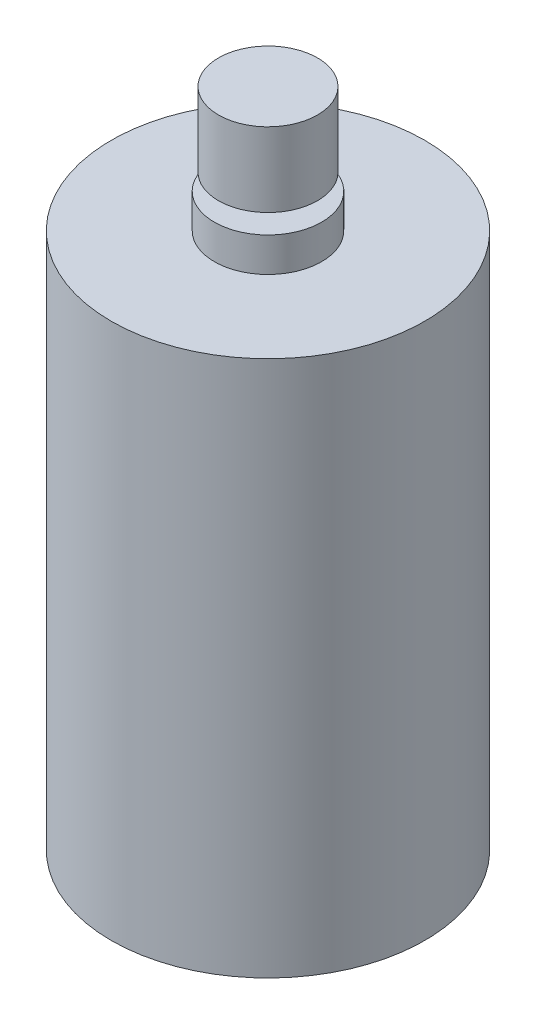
SolidWorks part; units mm, degrees
ref_plane "Ebene vorne" through (0, 0, 0) normal (0, 0, 1) x (1, 0, 0)
ref_plane "Ebene oben" through (0, 0, 0) normal (0, 1, 0) x (1, 0, 0)
ref_plane "Ebene rechts" through (0, 0, 0) normal (1, 0, 0) x (0, 0, -1)
sketch "Skizze1" plane through (0, 0, 0) normal (0, 1, 0) x (1, 0, 0)
  circle A0 centre (0, 0) radius 19
  dimension "D1" = 38
extrude "Aufsatz-Linear austragen1" add sketch "Skizze1" along normal blind 65
sketch "Skizze2" plane through (0, 65, 0) normal (0, 1, 0) x (1, 0, 0)
  circle A0 centre (0, 0) radius 6.5
  dimension "D1" = 13
extrude "Aufsatz-Linear austragen2" add sketch "Skizze2" along normal blind 4.15
sketch "Skizze3" plane through (0, 69.15, 0) normal (0, 1, 0) x (1, 0, 0)
  circle A0 centre (0, 0) radius 1
  dimension "D1" = 2
extrude "Aufsatz-Linear austragen3" add sketch "Skizze3" along normal blind 2
sketch "Skizze4" plane through (0, 71.15, 0) normal (0, 1, 0) x (1, 0, 0)
  circle A0 centre (0, 0) radius 6
  dimension "D1" = 12
extrude "Aufsatz-Linear austragen4" add sketch "Skizze4" along normal blind 9
